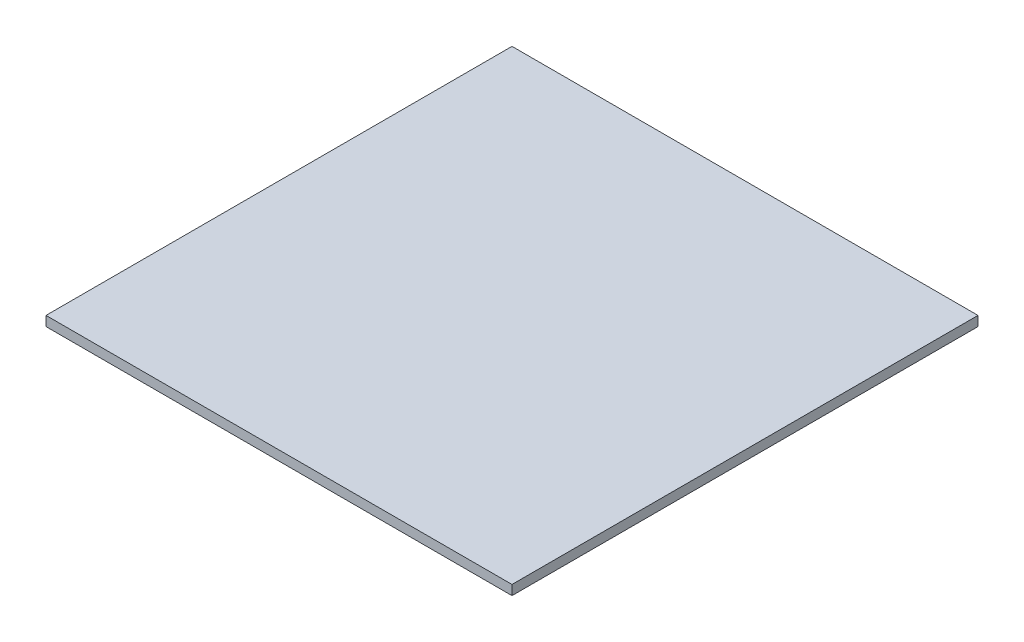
SolidWorks part; units mm, degrees
ref_plane "Front Plane" through (0, 0, 0) normal (1, 0, 0) x (0, 1, 0)
ref_plane "Top Plane" through (0, 0, 0) normal (0, 0, 1) x (0, 1, 0)
ref_plane "Right Plane" through (0, 0, 0) normal (0, 1, 0) x (-1, 0, 0)
sketch "Sketch1" plane through (0, 0, 0) normal (1, 0, 0) x (0, 1, 0)
  line L1 (-158.75, -152.4) -> (-152.4, -152.4)
  line L2 (-158.75, -152.4) -> (-158.75, 152.4)
  line L3 (-158.75, 152.4) -> (-152.4, 152.4)
  line L4 (-152.4, -152.4) -> (-152.4, 152.4)
extrude "Panel_or_block" add sketch "Sketch1" along normal blind 304.8
